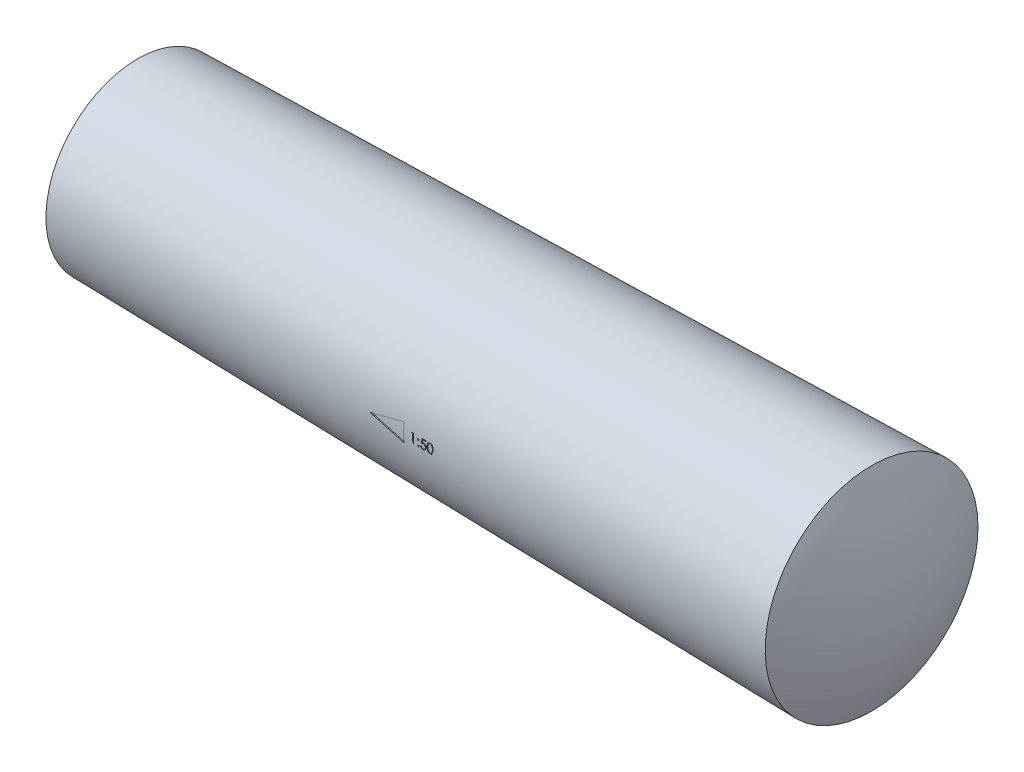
SolidWorks part; units mm, degrees
ref_plane "Front Plane" through (0, 0, 0) normal (0, 0, 1) x (1, 0, 0)
ref_plane "Top Plane" through (0, 0, 0) normal (0, 1, 0) x (1, 0, 0)
ref_plane "Right Plane" through (0, 0, 0) normal (1, 0, 0) x (0, 0, -1)
sketch "Sketch1" plane through (0, 0, 0) normal (1, 0, 0) x (0, 0, -1)
  circle A0 centre (0, 0) radius 10
  dimension "D1" = 20
extrude "Extrude1" add sketch "Sketch1" along normal mid plane 80
draft "Draft1" type of draft neutral plane draft angle 1.146 faces to draft 1 parameters "D1"=1.146
sketch "Sketch2" plane through (0, 0, 0) normal (0, 0, 1) x (1, 0, 0)
  line L0 (-40, 0) -> (-40, 10)
  line L1 (-40, 10) -> (-40, -10) construction
  line L2 (-40, 0) -> (-42.5, 0)
  line L3 (-42.5, 0) -> (-42.5, -10.8) construction
  line L4 (40, 0) -> (40, 11.6001)
  line L5 (40, -11.6001) -> (40, 11.6001) construction
  line L6 (40, 0) -> (42.5, 0)
  line L7 (42.5, 0) -> (42.5, -10.8) construction
  line L8 (-40, -10) -> (40, -11.6001) construction
  arc A0 (-42.5, 0) -> (-40, 10) centre (-21.25, 0) cw
  arc A1 (42.5, 0) -> (40, 11.6001) centre (14.3378, 0) ccw
  point P14 (0, -10.8)
revolve "Revolve1" add sketch "Sketch2" angle 360 about L2
sketch "Sketch5" plane through (0, 0, 0) normal (0, 0, 1) x (1, 0, 0)
  line L0 (0, 10.8) -> (0, -10.8) construction
  line L1 (40, 11.6001) -> (-40, 10) construction
  line L2 (-40, -10) -> (40, -11.6001) construction
ref_plane "Plane2" through (0, 0, 0) normal (-0.02, 0, 0.9998) x (0.9998, 0, 0.02)
sketch "Sketch6" plane through (0, 0, 0) normal (-0.02, 0, 0.9998) x (0.9998, 0, 0.02)
  line L0 (0, 0) -> (0, 1)
  line L1 (0, 10.8) -> (0, -10.8) construction
  line L2 (0, 1) -> (-3.7321, 0)
  line L3 (-3.7321, 0) -> (0, -1)
  line L4 (0, -1) -> (0, 0)
  line L5 (0, -0.5) -> (4, -0.5) construction
  text T0 "1:50" font "Century Gothic" height 1
  dimension "D1" = 2
  dimension "D2" = 30
  dimension "D3" = 4
wrap "Wrap2" sketch "Sketch6" wrap type deboss source sketch "Sketch6" thickness 0.1 parameters "D1"=0.1
equation "\"D2@Sketch2\" = \"D1@Sketch2\""
